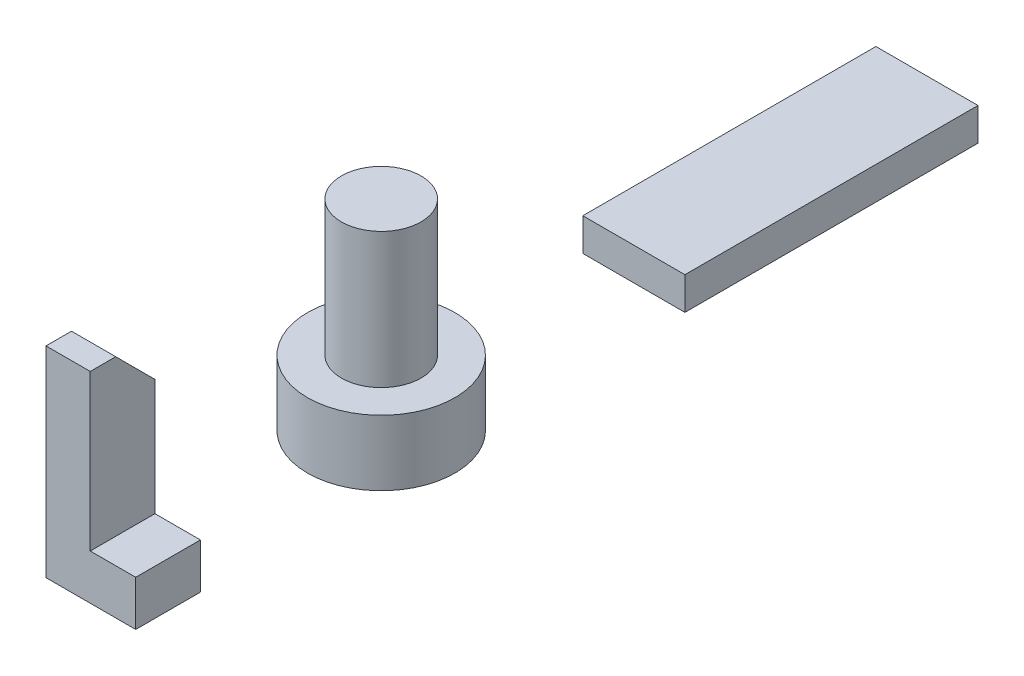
SolidWorks part; units mm, degrees
ref_plane "Front Plane" through (0, 0, 0) normal (0, 0, 1) x (1, 0, 0)
ref_plane "Top Plane" through (0, 0, 0) normal (0, 1, 0) x (1, 0, 0)
ref_plane "Right Plane" through (0, 0, 0) normal (1, 0, 0) x (0, 0, -1)
sketch "Sketch1" plane through (0, 0, 0) normal (0, 0, 1) x (1, 0, 0)
  line L0 (0, 0) -> (0, 17.5755)
  line L1 (0, 17.5755) -> (-17.6686, 17.5755)
  line L2 (-17.6686, 17.5755) -> (-17.6686, 78.0148)
  line L3 (-17.6686, 78.0148) -> (-34.858, 78.0148)
  line L4 (-34.858, 78.0148) -> (-34.858, 0)
  line L5 (-34.858, 0) -> (0, 0)
extrude "Extrude1" add sketch "Sketch1" along normal blind 25.146
chamfer "Chamfer1" distance 15.24 angle 45 1 edges at (-26.2633, 78.0148, 0)
sketch "Sketch2" plane through (0, 0, 0) normal (0, 1, 0) x (1, 0, 0)
  circle A0 centre (-19.2388, 89.4995) radius 28.6506
extrude "Extrude2" add sketch "Sketch2" along normal blind 25.4
sketch "Sketch3" plane through (0, 25.4, 0) normal (0, 1, 0) x (1, 0, 0)
  circle A0 centre (-19.2388, 89.4995) radius 15.4812
extrude "Extrude3" add sketch "Sketch3" along normal blind 52.578
sketch "Sketch4" plane through (0, 0, 0) normal (0, 1, 0) x (1, 0, 0)
  line L1 (-39.6818, 188.281) -> (0, 188.281)
  line L2 (-39.6818, 188.281) -> (-39.6818, 302.1731)
  line L3 (-39.6818, 302.1731) -> (0, 302.1731)
  line L4 (0, 188.281) -> (0, 302.1731)
extrude "Extrude4" add sketch "Sketch4" along normal blind 12.7
